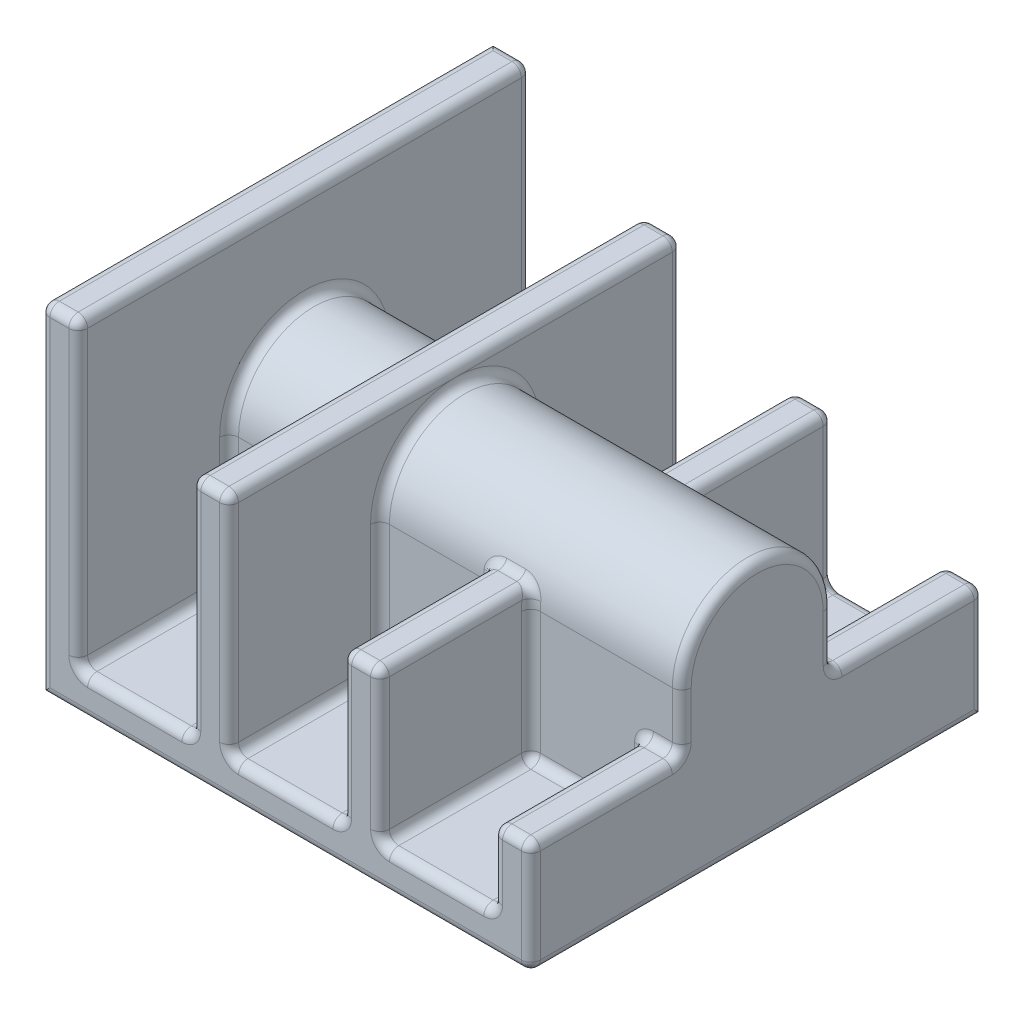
SolidWorks part; units mm, degrees
ref_plane "Front Plane" through (0, 0, 0) normal (0, 0, 1) x (1, 0, 0)
ref_plane "Top Plane" through (0, 0, 0) normal (0, 1, 0) x (1, 0, 0)
ref_plane "Right Plane" through (0, 0, 0) normal (1, 0, 0) x (0, 0, -1)
sketch "Sketch1" plane through (0, 0, 0) normal (0, 0, 1) x (1, 0, 0)
  line L0 (0, 0) -> (0, 114.3)
  line L1 (0, 114.3) -> (12.7, 114.3)
  line L2 (12.7, 114.3) -> (12.7, 12.7)
  line L3 (12.7, 12.7) -> (50.8, 12.7)
  line L4 (50.8, 12.7) -> (50.8, 88.9)
  line L5 (50.8, 88.9) -> (63.5, 88.9)
  line L6 (63.5, 88.9) -> (63.5, 12.7)
  line L7 (63.5, 12.7) -> (101.6, 12.7)
  line L8 (101.6, 12.7) -> (101.6, 63.5)
  line L9 (101.6, 63.5) -> (114.3, 63.5)
  line L10 (114.3, 63.5) -> (114.3, 12.7)
  line L11 (114.3, 12.7) -> (152.4, 12.7)
  line L12 (152.4, 12.7) -> (152.4, 38.1)
  line L13 (152.4, 38.1) -> (165.1, 38.1)
  line L14 (165.1, 38.1) -> (165.1, 0)
  line L15 (165.1, 0) -> (0, 0)
  dimension "D1" = 12.7
  dimension "D2" = 165.1
  dimension "D3" = 101.6
  dimension "D4" = 50.8
  dimension "D5" = 12.7
  dimension "D6" = 38.1
  dimension "D7" = 63.5
  dimension "D8" = 88.9
  dimension "D9" = 114.3
extrude "Boss-Extrude2" add sketch "Sketch1" against normal blind 152.4
sketch "Sketch2" plane through (12.7, 0, 0) normal (1, 0, 0) x (0, 0, -1)
  line L0 (152.4, 114.3) -> (0, 114.3) construction
  line L1 (0, 12.7) -> (0, 114.3) construction
  line L2 (101.6, 57.15) -> (101.6, 12.7)
  line L3 (152.4, 12.7) -> (0, 12.7) construction
  line L4 (101.6, 12.7) -> (50.8, 12.7)
  line L5 (50.8, 12.7) -> (50.8, 57.15)
  arc A0 (101.6, 57.15) -> (50.8, 57.15) centre (76.2, 57.15) ccw
  dimension "D1" = 50.8
  dimension "D2" = 57.15
  dimension "D3" = 76.2
extrude "Boss-Extrude3" add sketch "Sketch2" along normal through all
fillet "Fillet1" radius 3.175 87 edges at (101.6, 34.925, -101.6) (152.4, 25.4, -101.6) (101.6, 60.3505, -101.3976) (152.4, 25.4, -152.4) (101.6, 38.1, -152.4) (50.8, 50.8, -152.4) (50.8, 34.925, -101.6) (12.7, 82.55, -76.2) (12.7, 34.925, -50.8) (12.7, 34.925, -101.6) (50.8, 82.55, -76.2) (63.5, 82.55, -76.2) (165.1, 82.55, -76.2) (165.1, 47.625, -50.8) (165.1, 47.625, -101.6) (31.75, 12.7, -101.6) (82.55, 12.7, -101.6) (133.35, 12.7, -101.6) (31.75, 12.7, -50.8) (82.55, 12.7, -50.8) (133.35, 12.7, -50.8) (158.75, 38.1, -101.6) (114.3, 34.925, -101.6) (63.5, 34.925, -101.6) (158.75, 38.1, -50.8) (152.4, 25.4, -50.8) (114.3, 34.925, -50.8) (101.6, 34.925, -50.8) (63.5, 34.925, -50.8) (50.8, 34.925, -50.8) (107.95, 63.5, -51.6066) (107.95, 63.5, -100.7934) (101.6, 60.3505, -51.0024) (82.55, 0, 0) (165.1, 19.05, 0) (158.75, 38.1, 0) (152.4, 25.4, 0) (133.35, 12.7, 0) (114.3, 38.1, 0) (107.95, 63.5, 0) (101.6, 38.1, 0) (82.55, 12.7, 0) (63.5, 50.8, 0) (57.15, 88.9, 0) (50.8, 50.8, 0) (31.75, 12.7, 0) (12.7, 63.5, 0) (6.35, 114.3, 0) (0, 57.15, 0) (165.1, 19.05, -152.4) (158.75, 38.1, -152.4) (133.35, 12.7, -152.4) (114.3, 38.1, -152.4) (107.95, 63.5, -152.4) (82.55, 12.7, -152.4) (63.5, 50.8, -152.4) (57.15, 88.9, -152.4) (31.75, 12.7, -152.4) (12.7, 63.5, -152.4) (6.35, 114.3, -152.4) (165.1, 0, -76.2) (165.1, 38.1, -25.4) (165.1, 38.1, -127) (152.4, 38.1, -25.4) (152.4, 38.1, -127) (152.4, 12.7, -25.4) (152.4, 12.7, -127) (114.3, 12.7, -25.4) (114.3, 12.7, -127) (114.3, 63.5, -25.8033) (114.3, 63.5, -126.5967) (101.6, 63.5, -25.8033) (101.6, 63.5, -126.5967) (101.6, 12.7, -25.4) (101.6, 12.7, -127) (63.5, 12.7, -25.4) (63.5, 12.7, -127) (63.5, 88.9, -76.2) (50.8, 88.9, -76.2) (50.8, 12.7, -25.4) (50.8, 12.7, -127) (12.7, 12.7, -25.4) (12.7, 12.7, -127) (12.7, 114.3, -76.2) (0, 114.3, -76.2) (114.3, 60.3505, -101.3976) (114.3, 60.3505, -51.0024)
